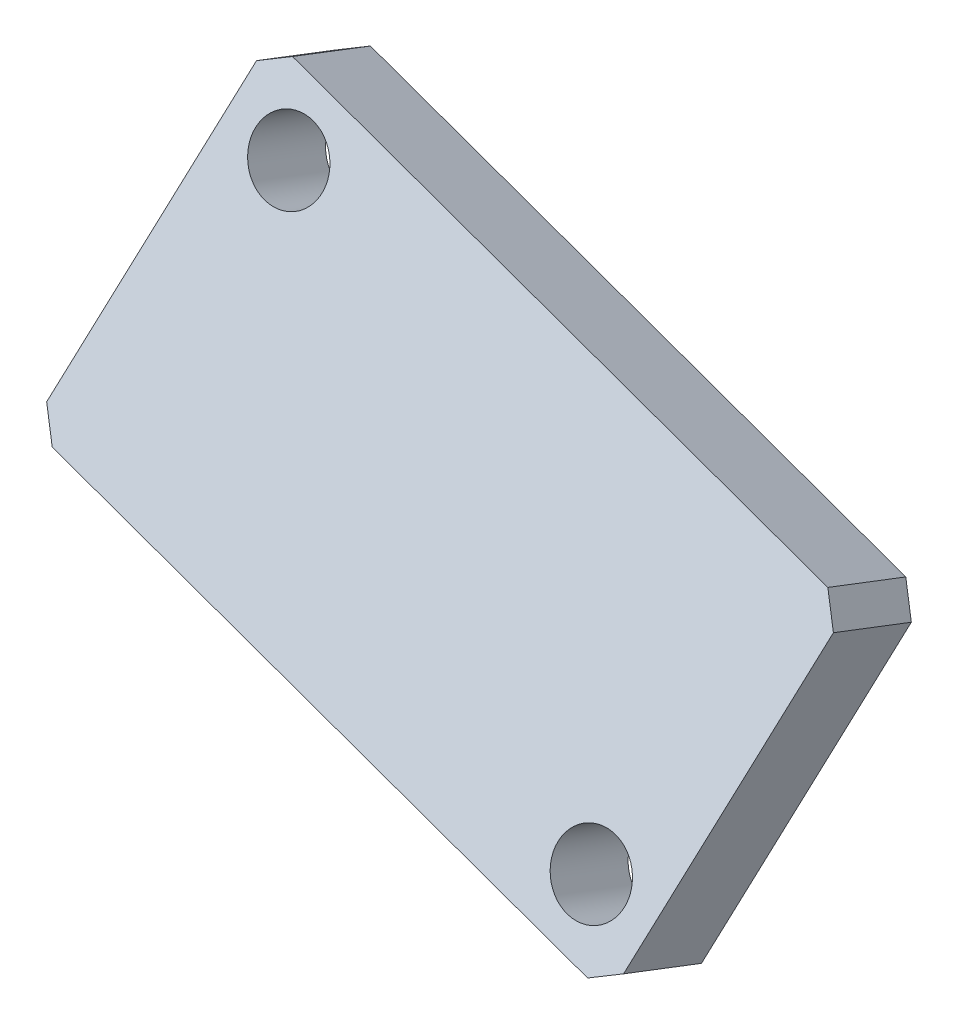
SolidWorks part; units mm, degrees
ref_plane "Plan de face" through (0, 0, 0) normal (0, 0, 1) x (1, 0, 0)
ref_plane "Plan de dessus" through (0, 0, 0) normal (0, 1, 0) x (1, 0, 0)
ref_plane "Plan de droite" through (0, 0, 0) normal (1, 0, 0) x (0, 0, -1)
sketch "Esquisse1" plane through (-14.413, -87.9765, -206.2965) normal (0.0641, 0.3915, 0.918) x (0.9979, -0.0131, -0.0641)
  line L0 (39.886, 84.125) -> (42.3177, 92.2697) construction
  line L1 (60.8735, 75.7718) -> (41.2303, 81.6364) construction
  line L2 (69.8999, 87.4789) -> (67.4682, 79.3341) construction
  line L3 (48.9124, 95.832) -> (68.5556, 89.9675) construction
  line L4 (39.3139, 82.2085) -> (43.8339, 97.3482)
  line L5 (65.952, 74.2556) -> (39.3139, 82.2085)
  line L6 (70.472, 89.3953) -> (65.952, 74.2556)
  line L7 (43.8339, 97.3482) -> (70.472, 89.3953)
  circle A1 centre (64.0414, 77.6438) radius 1.6 construction
  circle A3 centre (64.0414, 77.6438) radius 1.6
  circle A4 centre (45.7444, 93.96) radius 1.6
  dimension "D1" = 2.8
  dimension "D2" = 2.7
extrude "Boss.-Extru.1" add sketch "Esquisse1" along normal blind 4
chamfer "Chanfrein1" distance 1 angle 45 4 edges at (50.5538, -19.7344, -237.759) (54.866, -5.8635, -243.9756) (28.1808, 1.8026, -245.3805) (23.8687, -12.0682, -239.1639)
